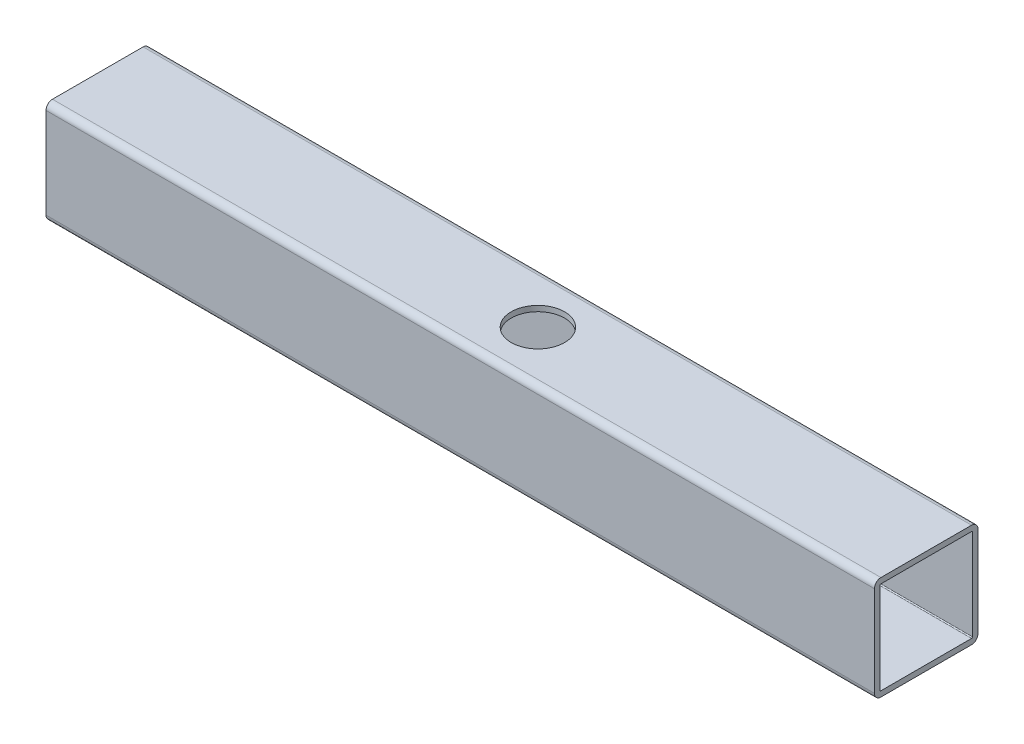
SolidWorks part; units mm, degrees
ref_plane "Front Plane" through (0, 0, 0) normal (0, 0, 1) x (1, 0, 0)
ref_plane "Top Plane" through (0, 0, 0) normal (0, 1, 0) x (1, 0, 0)
ref_plane "Right Plane" through (0, 0, 0) normal (1, 0, 0) x (0, 0, -1)
sketch "Sketch1" plane through (0, 0, 0) normal (1, 0, 0) x (0, 0, -1)
  line L0 (-5.373, 3.898) -> (16.852, 3.898)
  line L1 (-5.373, 5.2442) -> (16.852, 5.2442)
  line L2 (-6.9605, 3.6567) -> (-6.9605, -18.5683)
  line L3 (-5.373, -20.1558) -> (16.852, -20.1558)
  line L4 (18.4395, 3.6567) -> (18.4395, -18.5683)
  line L5 (17.0933, 3.6567) -> (17.0933, -18.5683)
  line L6 (-5.373, -18.8096) -> (16.852, -18.8096)
  line L7 (-5.6143, 3.6567) -> (-5.6143, -18.5683)
  arc A0 (16.852, 5.2442) -> (18.4395, 3.6567) centre (16.852, 3.6567) cw
  arc A1 (-6.9605, 3.6567) -> (-5.373, 5.2442) centre (-5.373, 3.6567) cw
  arc A2 (-5.373, -20.1558) -> (-6.9605, -18.5683) centre (-5.373, -18.5683) cw
  arc A3 (18.4395, -18.5683) -> (16.852, -20.1558) centre (16.852, -18.5683) cw
  arc A4 (16.852, 3.898) -> (17.0933, 3.6567) centre (16.852, 3.6567) cw
  arc A5 (17.0933, -18.5683) -> (16.852, -18.8096) centre (16.852, -18.5683) cw
  arc A6 (-5.373, -18.8096) -> (-5.6143, -18.5683) centre (-5.373, -18.5683) cw
  arc A7 (-5.6143, 3.6567) -> (-5.373, 3.898) centre (-5.373, 3.6567) cw
  point P6 (18.4395, 5.2442)
  point P9 (-6.9605, 5.2442)
  point P14 (18.4395, -20.1558)
  dimension "D3" = 1.5875
  dimension "D1" = 25.4
  dimension "D2" = 25.4
  dimension "D4" = 1.3462
extrude "Extrude1" add sketch "Sketch1" along normal blind 203.2
sketch "Sketch2" plane through (0, -20.1558, 0) normal (0, -1, 0) x (1, 0, 0)
  circle A0 centre (107.95, -5.7395) radius 6.5484
  dimension "D1" = 13.0969
extrude "Cut-Extrude1" cut sketch "Sketch2" against normal through all
